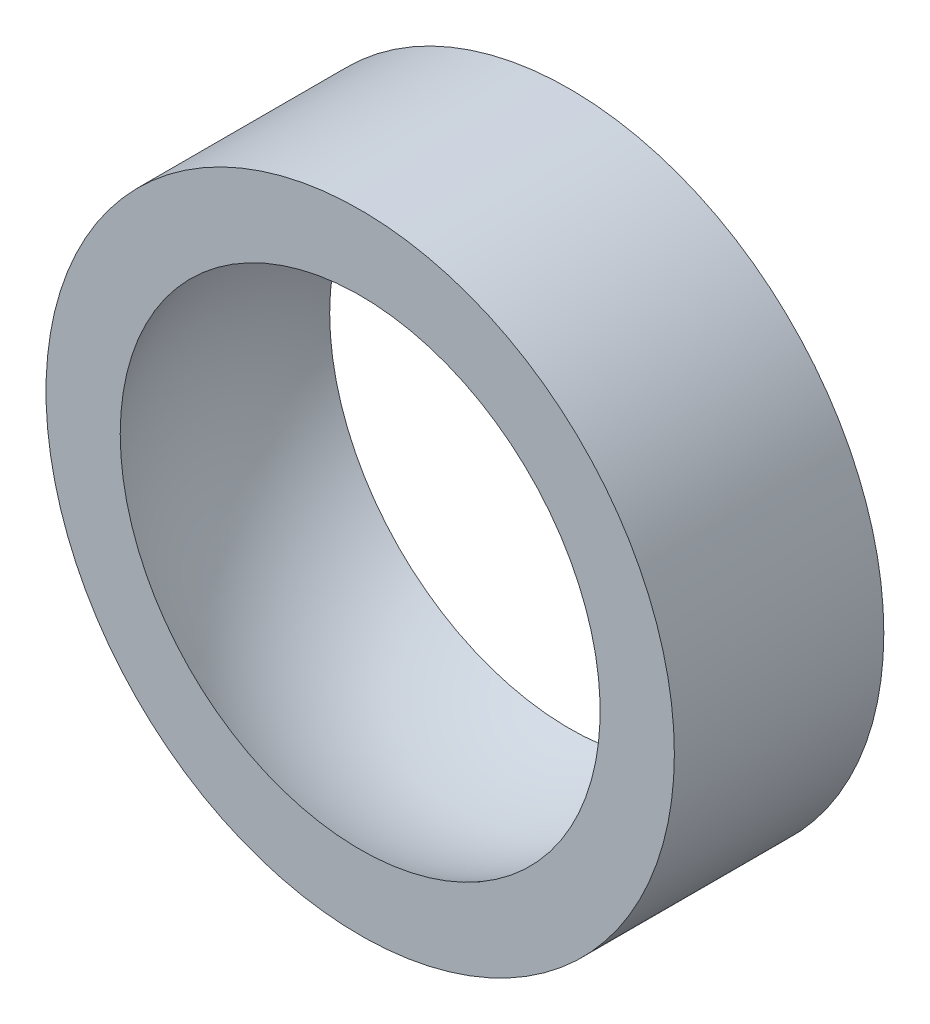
SolidWorks part; units mm, degrees
ref_plane "Plan1" through (0, 0, 0) normal (0, 0, 1) x (1, 0, 0)
ref_plane "Plan2" through (0, 0, 0) normal (0, 1, 0) x (1, 0, 0)
ref_plane "Plan3" through (0, 0, 0) normal (1, 0, 0) x (0, 0, -1)
sketch "Esquisse1" plane through (0, 0, 0) normal (0, 0, 1) x (1, 0, 0)
  circle A0 centre (0, 0) radius 15
  dimension "D1" = 30
extrude "Base-Extrusion" add sketch "Esquisse1" along normal mid plane 10
sketch "Esquisse2" plane through (0, 0, 0) normal (0, 1, 0) x (1, 0, 0)
  line L0 (0, 12.5) -> (0, -12.5)
  line L1 (0, 40) -> (0, -40) construction
  arc A0 (0, -12.5) -> (0, 12.5) centre (0, 0) ccw
  dimension "D1" = 12.5
revolve "Enlèvement de matière-Révolution1" cut sketch "Esquisse2" angle 360 about L1
